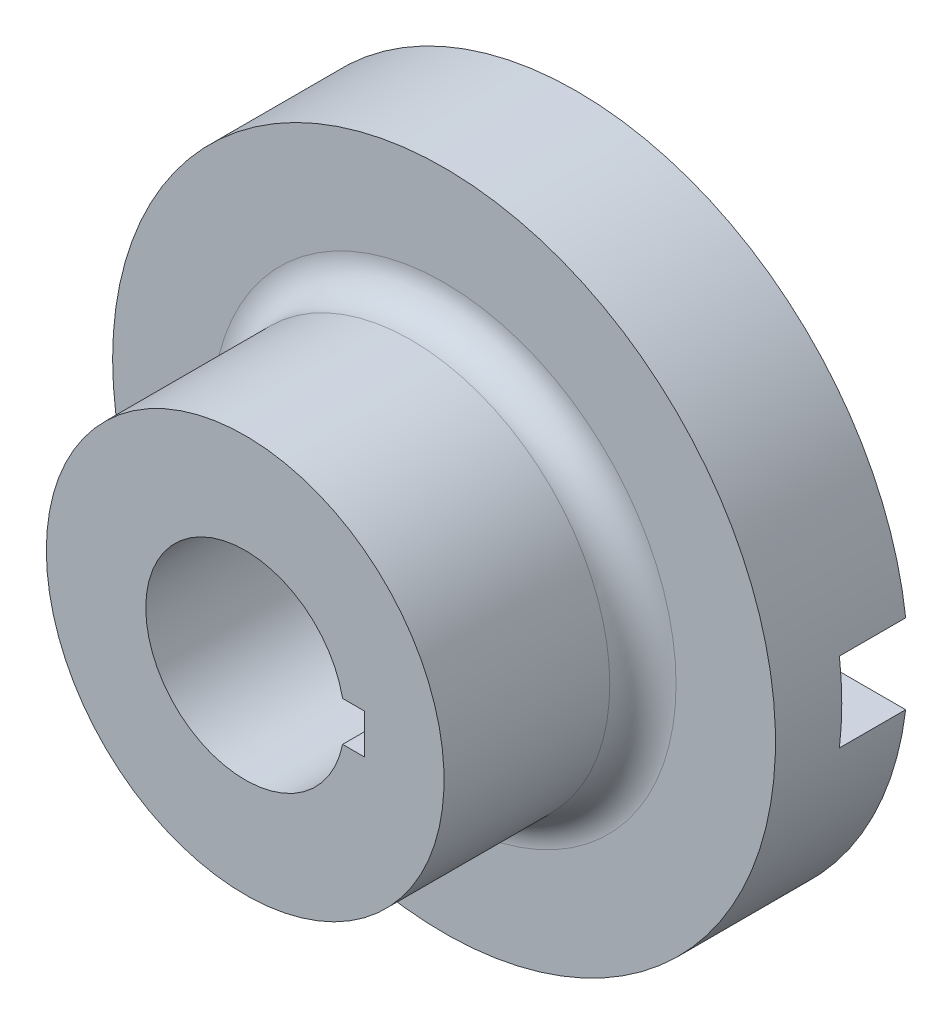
SolidWorks part; units mm, degrees
ref_plane "Front Plane" through (0, 0, 0) normal (0, 0, 1) x (1, 0, 0)
ref_plane "Top Plane" through (0, 0, 0) normal (0, 1, 0) x (1, 0, 0)
ref_plane "Right Plane" through (0, 0, 0) normal (1, 0, 0) x (0, 0, -1)
sketch "Sketch1" plane through (0, 0, 0) normal (1, 0, 0) x (0, 0, -1)
  line L0 (0, 15) -> (0, 50)
  line L1 (0, 50) -> (-20, 50)
  line L2 (-20, 50) -> (-20, 30)
  line L3 (-20, 30) -> (-50, 30)
  line L4 (-50, 30) -> (-50, 15)
  line L5 (-50, 15) -> (0, 15)
  line L6 (0, 0) -> (-46.2085, 0) construction
  dimension "D1" = 30
  dimension "D2" = 100
  dimension "D3" = 60
  dimension "D4" = 50
  dimension "D5" = 20
revolve "Revolve1" add sketch "Sketch1" angle 360 about L6
sketch "Sketch2" plane through (0, 0, 0) normal (0, 0, -1) x (-1, 0, 0)
  line L1 (50, -6) -> (-50, -6)
  line L2 (50, -6) -> (50, 6)
  line L3 (50, 6) -> (-50, 6)
  line L4 (-50, -6) -> (-50, 6)
  line L5 (50, -6) -> (-50, 6) construction
  line L6 (50, 6) -> (-50, -6) construction
  point P0 (0, 0)
  dimension "D1" = 100
  dimension "D2" = 12
extrude "Cut-Extrude1" cut sketch "Sketch2" against normal blind 10
sketch "Sketch3" plane through (0, 0, 50) normal (0, 0, 1) x (1, 0, 0)
  line L0 (0.9197, 0) -> (21.8731, 0) construction
  line L5 (18, -3) -> (18, 3)
  line L6 (0, 0) -> (0, -8.3506) construction
  line L7 (14, 3) -> (18, 3)
  line L8 (14, -3) -> (14, 3)
  line L9 (14, -3) -> (18, -3)
extrude "Cut-Extrude3" cut sketch "Sketch3" against normal through all
fillet "Fillet1" radius 5 1 edges at (-30, 0, 20)
